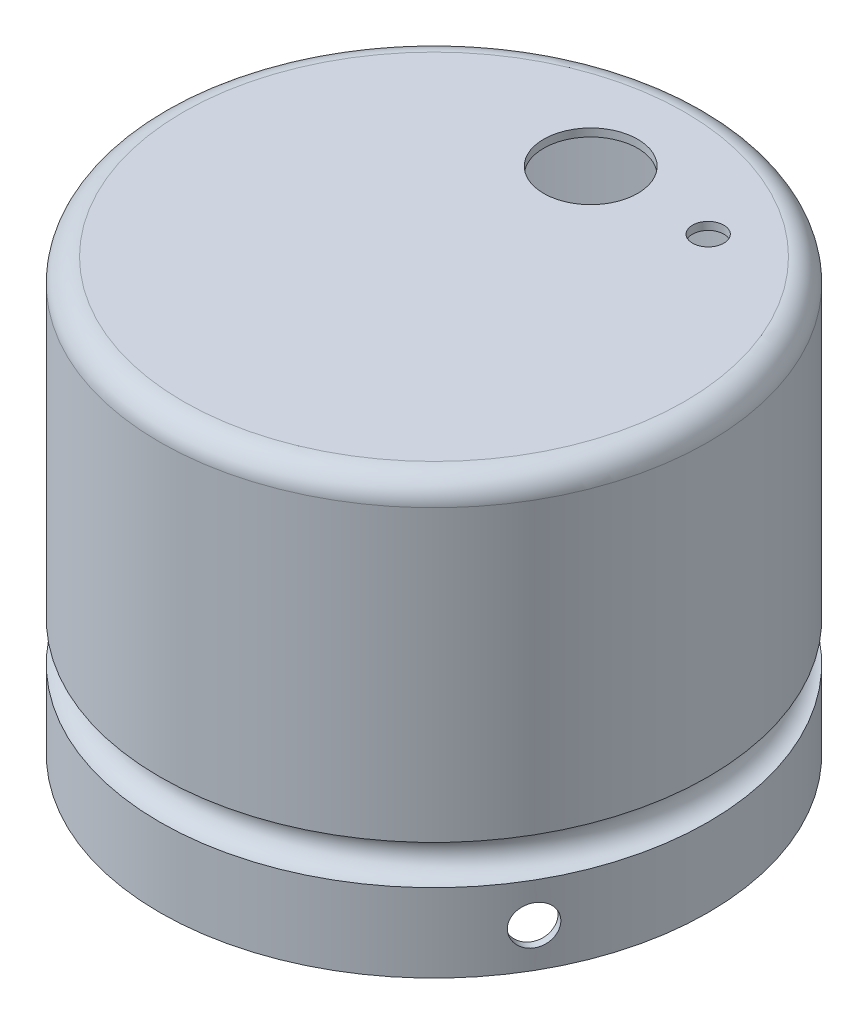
SolidWorks part; units mm, degrees
ref_plane "Front Plane" through (0, 0, 0) normal (0, 0, 1) x (1, 0, 0)
ref_plane "Top Plane" through (0, 0, 0) normal (0, 1, 0) x (1, 0, 0)
ref_plane "Right Plane" through (0, 0, 0) normal (1, 0, 0) x (0, 0, -1)
sketch "Sketch1" plane through (0, 0, 0) normal (0, 0, 1) x (1, 0, 0)
  line L0 (0, 99.4116) -> (0, -100.0215) construction
  line L1 (0, 80.0526) -> (-35, 80.0526)
  line L2 (-35, 80.0526) -> (-35, 40.0526)
  line L3 (-35, 25.0526) -> (0, 25.0526)
  line L4 (-35, 35.0526) -> (-35, 25.0526)
  line L5 (0, 25.0526) -> (0, 80.0526)
  arc A0 (-35, 35.0526) -> (-35, 40.0526) centre (-35, 37.5526) ccw
revolve "Revolve1" add sketch "Sketch1" angle 360 about L0
fillet "Fillet1" radius 3 1 edges at (0, 80.0526, 35)
shell "Shell2" thickness 1
sketch "Sketch2" plane through (0, 80.0526, 0) normal (0, 1, 0) x (-1, 0, 0)
  line L0 (-43.8244, 0) -> (40.3386, 0) construction
  line L1 (0, -57.7825) -> (0, 56.0541) construction
  line L2 (-37.6356, -20) -> (38.8434, -20) construction
  circle A0 centre (0, -20) radius 6
  circle A1 centre (-15, -20) radius 2
extrude "Cut-Extrude1" cut sketch "Sketch2" against normal blind 1
sketch "Sketch7" plane through (0, 80.0526, 0) normal (0, 1, 0) x (-1, 0, 0)
  line L0 (-2, -35) -> (2, -35) construction
  circle A0 centre (0, 0) radius 35 construction
ref_plane "TangPlane" through (0, 0, -35) normal (0, 0, 1) x (1, 0, 0)
sketch "Sketch8" plane through (0, 0, -35) normal (0, 0, 1) x (1, 0, 0)
  line L0 (0, 25.0526) -> (0, 34.1985) construction
  line L1 (0, 40.9067) -> (0, 77.0526) construction
  circle A0 centre (0, 30.0526) radius 2.5
extrude "Cut-Extrude3" cut sketch "Sketch8" along normal up to next
pattern_circular "CirPattern1" count 3 every 120 about axis through (0, 99.4116, 0) along (0, -1, 0) of "Cut-Extrude3"
